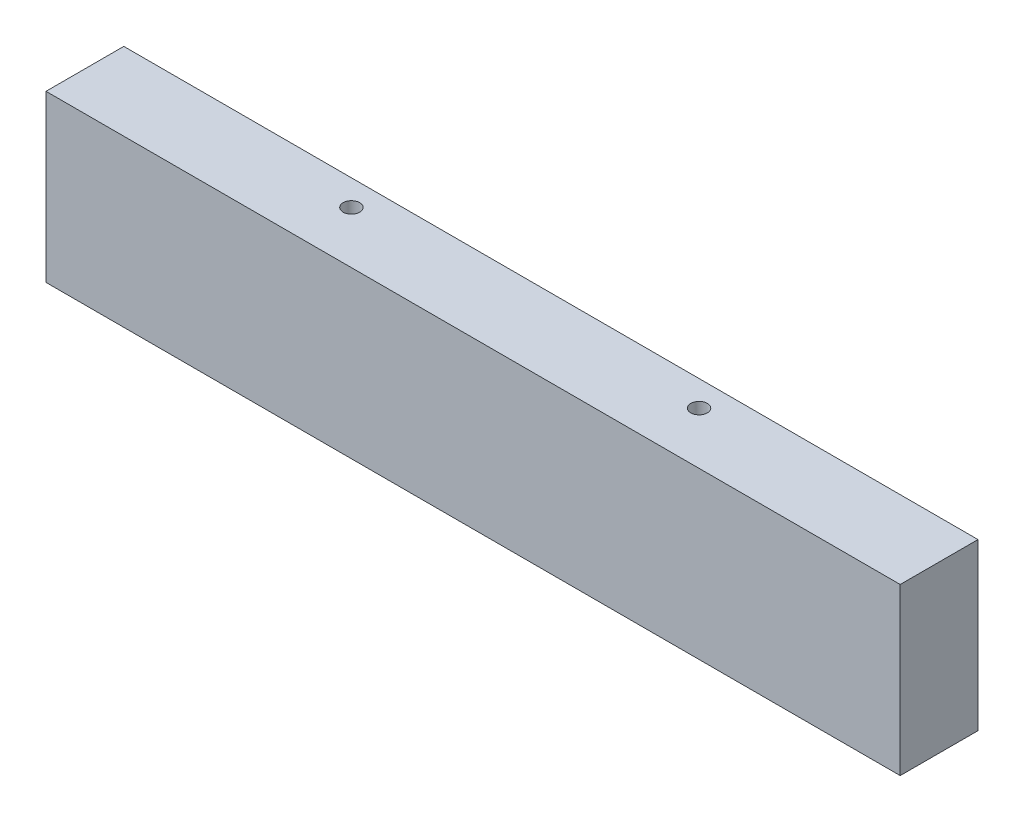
SolidWorks part; units mm, degrees
ref_plane "Front Plane" through (0, 0, 0) normal (0, 0, 1) x (1, 0, 0)
ref_plane "Top Plane" through (0, 0, 0) normal (0, 1, 0) x (1, 0, 0)
ref_plane "Right Plane" through (0, 0, 0) normal (1, 0, 0) x (0, 0, -1)
sketch "Sketch1" plane through (0, 0, 0) normal (0, 1, 0) x (1, 0, 0)
  line L1 (0, 0) -> (516, 0)
  line L2 (0, 0) -> (0, 47)
  line L3 (0, 47) -> (516, 47)
  line L4 (516, 0) -> (516, 47)
  dimension "D1" = 47
  dimension "D2" = 516
extrude "Boss-Extrude1" add sketch "Sketch1" along normal blind 100
ref_plane "Plane1" through (0, 0, -23.5) normal (0, 0, 1) x (1, 0, 0)
sketch "Sketch2" plane through (0, 100, 0) normal (0, 1, 0) x (1, 0, 0)
  circle A0 centre (153, 31.5) radius 5 construction
  circle A1 centre (363, 31.5) radius 5 construction
  circle A2 centre (153, 31.5) radius 5
  circle A3 centre (363, 31.5) radius 5
extrude "Cut-Extrude1" cut sketch "Sketch2" against normal up to next
